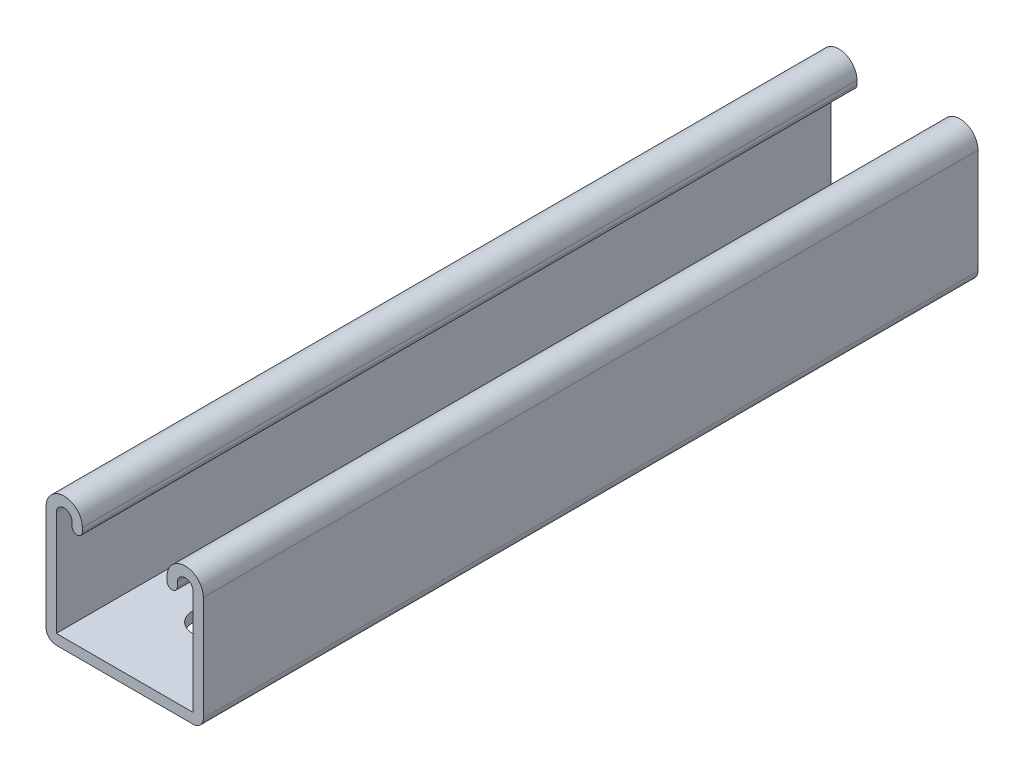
SolidWorks part; units mm, degrees
ref_plane "Plane1" through (0, 0, 0) normal (0, 0, 1) x (1, 0, 0)
ref_plane "Plane2" through (0, 0, 0) normal (0, 1, 0) x (1, 0, 0)
ref_plane "Plane3" through (0, 0, 0) normal (1, 0, 0) x (0, 0, -1)
sketch "Sketch1" plane through (0, 0, 0) normal (0, 0, 1) x (1, 0, 0)
  line L0 (-20.6375, 15.1511) -> (-20.6375, -12.319)
  line L1 (-17.9451, -15.0114) -> (17.9451, -15.0114)
  line L2 (20.6375, -12.319) -> (20.6375, 15.1511)
  line L3 (11.1125, 15.1511) -> (11.1125, 14.116)
  line L4 (-11.1125, 15.1511) -> (-11.1125, 14.116)
  line L5 (-13.8049, 15.1511) -> (-13.8049, 14.116)
  line L6 (-17.9451, 15.1511) -> (-17.9451, -12.319)
  line L7 (-17.9451, -12.319) -> (17.9451, -12.319)
  line L8 (17.9451, -12.319) -> (17.9451, 15.1511)
  line L9 (13.8049, 15.1511) -> (13.8049, 14.116)
  line L10 (-25.4, 19.9136) -> (25.4, 19.9136) construction
  line L11 (-12.8524, 12.7698) -> (12.8524, 12.7698) construction
  arc A0 (20.6375, 15.1511) -> (11.1125, 15.1511) centre (15.875, 15.1511) ccw
  arc A1 (-20.6375, 15.1511) -> (-11.1125, 15.1511) centre (-15.875, 15.1511) cw
  arc A2 (-17.9451, -15.0114) -> (-20.6375, -12.319) centre (-17.9451, -12.319) cw
  arc A3 (17.9451, -15.0114) -> (20.6375, -12.319) centre (17.9451, -12.319) ccw
  arc A4 (-17.9451, 15.1511) -> (-13.8049, 15.1511) centre (-15.875, 15.1511) cw
  arc A5 (17.9451, 15.1511) -> (13.8049, 15.1511) centre (15.875, 15.1511) ccw
  arc A6 (11.1125, 14.116) -> (13.8049, 14.116) centre (12.4587, 14.116) ccw
  arc A7 (-11.1125, 14.116) -> (-13.8049, 14.116) centre (-12.4587, 14.116) cw
  dimension "D1" = 2.6924
  dimension "D3" = 20.6375
  dimension "Width" = 41.275
  dimension "D5" = 15.0114
  dimension "D6" = 9.525
  dimension "D7" = 22.225
  dimension "D8" = 19.9136
  dimension "D9" = 7.1437
  dimension "gauge" = 2.6924
extrude "Base-Extrude" add sketch "Sketch1" along normal blind 203.2
extrude "Slot" cut sketch "Sketch2" against normal through all
sketch "Sketch2" plane through (0.7476, -15.0114, -24.0134) normal (0, -1, 0) x (1, 0, 0)
  line L0 (4.4118, 102.5947) -> (4.4118, 36.7134)
  line L1 (-5.907, 36.7134) -> (-5.907, 102.5947)
  arc A0 (-5.907, 36.7134) -> (4.4118, 36.7134) centre (-0.7476, 36.7134) ccw
  arc A1 (4.4118, 102.5947) -> (-5.907, 102.5947) centre (-0.7476, 102.5947) ccw
  dimension "D3" = 10.3187
  dimension "D1" = 12.7
  dimension "D2" = 65.8813
pattern_linear "LPattern1" count 2 spacing 101.6 along (0, 0, 1) of "Slot"
equation "\"D3@Sketch1\" = \"Width@Sketch1\" / 2"
equation "\"D7@Sketch1\" = \"Width@Sketch1\" - 2 * \"D6@Sketch1\""
equation "\"D1@Sketch1\" = \"gauge@Sketch1\""
equation "\"D1@LPattern1\" = \"D1@Base-Extrude\" / \"D3@LPattern1\""
